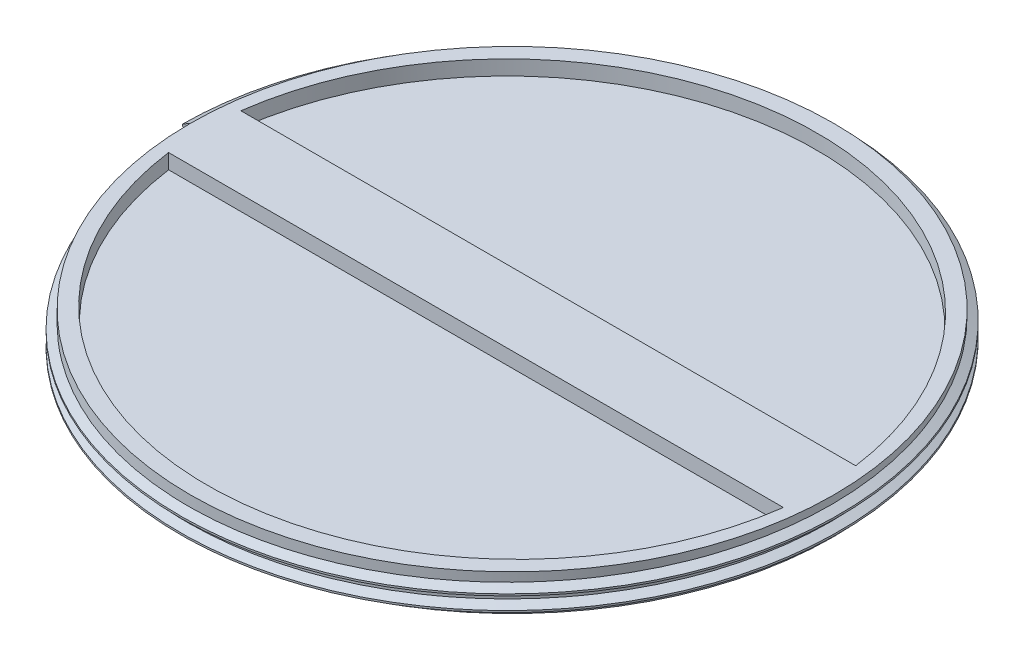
SolidWorks part; units mm, degrees
ref_plane "Front Plane" through (0, 0, 0) normal (0, 0, 1) x (1, 0, 0)
ref_plane "Top Plane" through (0, 0, 0) normal (0, 1, 0) x (1, 0, 0)
ref_plane "Right Plane" through (0, 0, 0) normal (1, 0, 0) x (0, 0, -1)
sketch "Sketch1" plane through (0, 0, 0) normal (0, 1, 0) x (1, 0, 0)
  circle A0 centre (0, 0) radius 44.5
  dimension "D1" = 89
extrude "Boss-Extrude2" add sketch "Sketch1" along normal blind 5
ref_plane "Plane1" through (0, 0, 45) normal (0, 0, 1) x (1, 0, 0)
thread "Thread1" pitch 2 start angle 0, offset 0, length 4, pitch 2, diameter 89
ref_plane "Plane2" through (-44.5, 5, 0) normal (0, 0, 1) x (-1, 0, 0)
sketch "Thread Profile1" plane through (-44.5, 5, 0) normal (0, 0, 1) x (-1, 0, 0)
  line L0 (0, 0) -> (0, 2) construction
  line L1 (0, 0) -> (1.0825, 0.625)
  line L2 (1.0825, 0.625) -> (1.0825, 0.875)
  line L3 (1.0825, 0.875) -> (0, 1.5)
  line L4 (1.0825, 0.75) -> (0, 0.75) construction
  line L11 (0, 0) -> (0, 1.5)
  point P2 (0, 0)
  dimension "Pitch" = 2
  dimension "Profile_Angle" = 60
  dimension "Profile_Land" = 0.25
  dimension "Profile_Height" = 1.0825
ref_plane "Plane3" through (0, 0, 10) normal (0, 0, 1) x (1, 0, 0)
sketch "Sketch5" plane through (0, 5, 0) normal (0, 1, 0) x (1, 0, 0)
  line L1 (42.516, 5) -> (-42.516, 5) construction
  line L2 (42.516, 5) -> (42.516, -5) construction
  line L3 (42.516, -5) -> (-42.516, -5)
  line L4 (-42.516, 5) -> (-42.516, -5) construction
  line L5 (42.516, 5) -> (-42.516, -5) construction
  line L6 (42.516, -5) -> (-42.516, 5) construction
  arc A0 (-42.516, -5) -> (42.516, -5) centre (0, 0.7189) ccw
  point P0 (0, 0)
  dimension "D1" = 10
extrude "Cut-Extrude2" cut sketch "Sketch5" against normal blind 2 draft 2
mirror "Mirror1" about plane through (0, 0, 0) normal (0, 0, 1) of "Cut-Extrude2"
